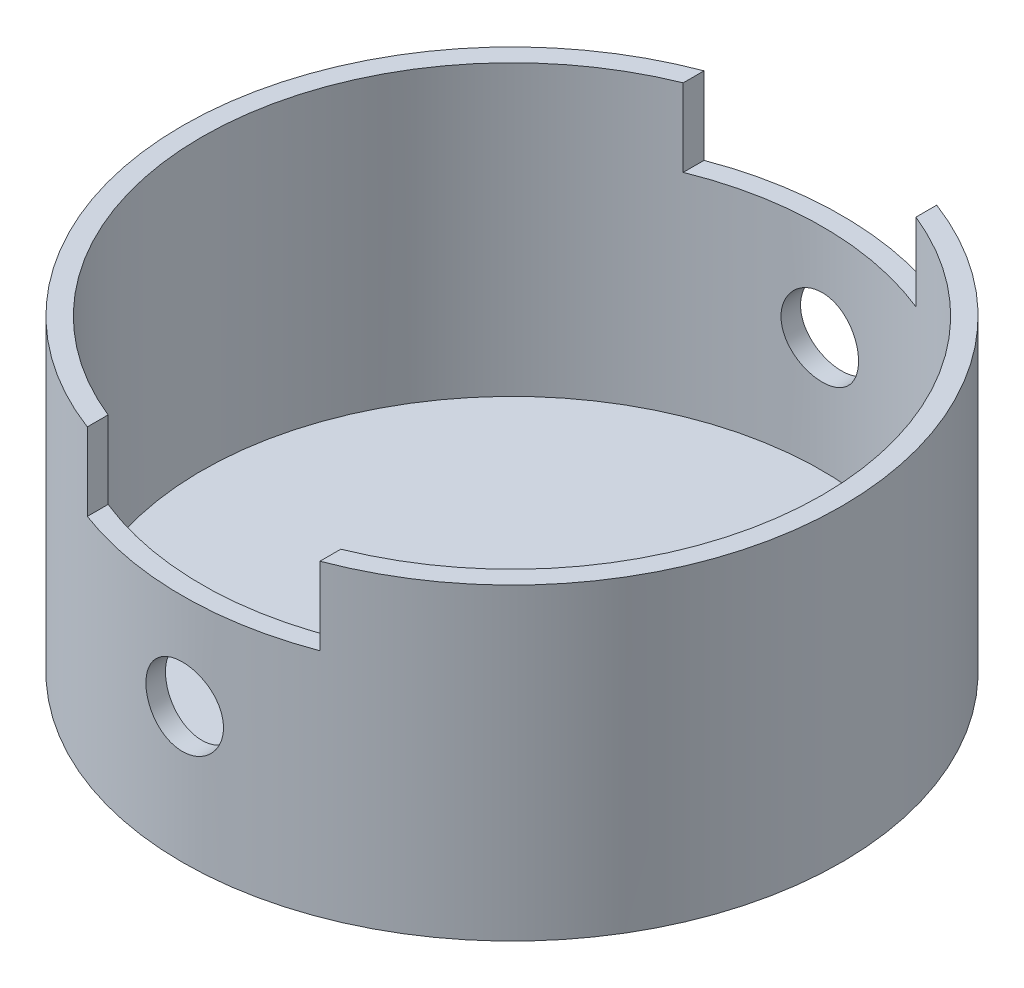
SolidWorks part; units mm, degrees
other "DetailItem1" parameters "RD1"=107.95, "RD2"=38.1, "RD3"=22.0726, "RD4"=3.175, "RD5"=50.4952, "RD6"=12.7
ref_plane "Front Plane" through (0, 0, 0) normal (0, 0, 1) x (1, 0, 0)
ref_plane "Top Plane" through (0, 0, 0) normal (0, 1, 0) x (1, 0, 0)
ref_plane "Right Plane" through (0, 0, 0) normal (1, 0, 0) x (0, 0, -1)
sketch "Sketch1" plane through (0, 0, 0) normal (0, 1, 0) x (1, 0, 0)
  circle A0 centre (0, 0) radius 53.975
  arc A2 (0, -53.975) -> (0, 53.975) centre (0, 0) ccw construction
extrude "Extrude1" add sketch "Sketch1" along normal blind 50.4952
shell "Shell1" thickness 3.175
sketch "Sketch2" plane through (0, 0, 0) normal (0, 0, 1) x (1, 0, 0)
  line L0 (50.8, 50.4952) -> (-50.8, 50.4952) construction
  line L1 (-19.05, 50.4952) -> (19.05, 50.4952)
  line L2 (-19.05, 50.4952) -> (-19.05, 37.7952)
  line L3 (-19.05, 37.7952) -> (19.05, 37.7952)
  line L4 (19.05, 50.4952) -> (19.05, 37.7952)
  line L5 (0, 37.7952) -> (0, 0) construction
  dimension "D1" = 38.1
  dimension "D2" = 12.7
extrude "Extrude2" cut sketch "Sketch2" against normal through all and the other way through all
sketch "Sketch3" plane through (0, 0, 0) normal (0, 0, 1) x (1, 0, 0)
  line L0 (-53.975, 0) -> (53.975, 0) construction
  line L1 (0, 22.0726) -> (0, 0) construction
  circle A0 centre (0, 22.0726) radius 6.35
  dimension "D1" = 12.7
  dimension "D2" = 22.0726
extrude "Extrude3" cut sketch "Sketch3" against normal through all and the other way through all
